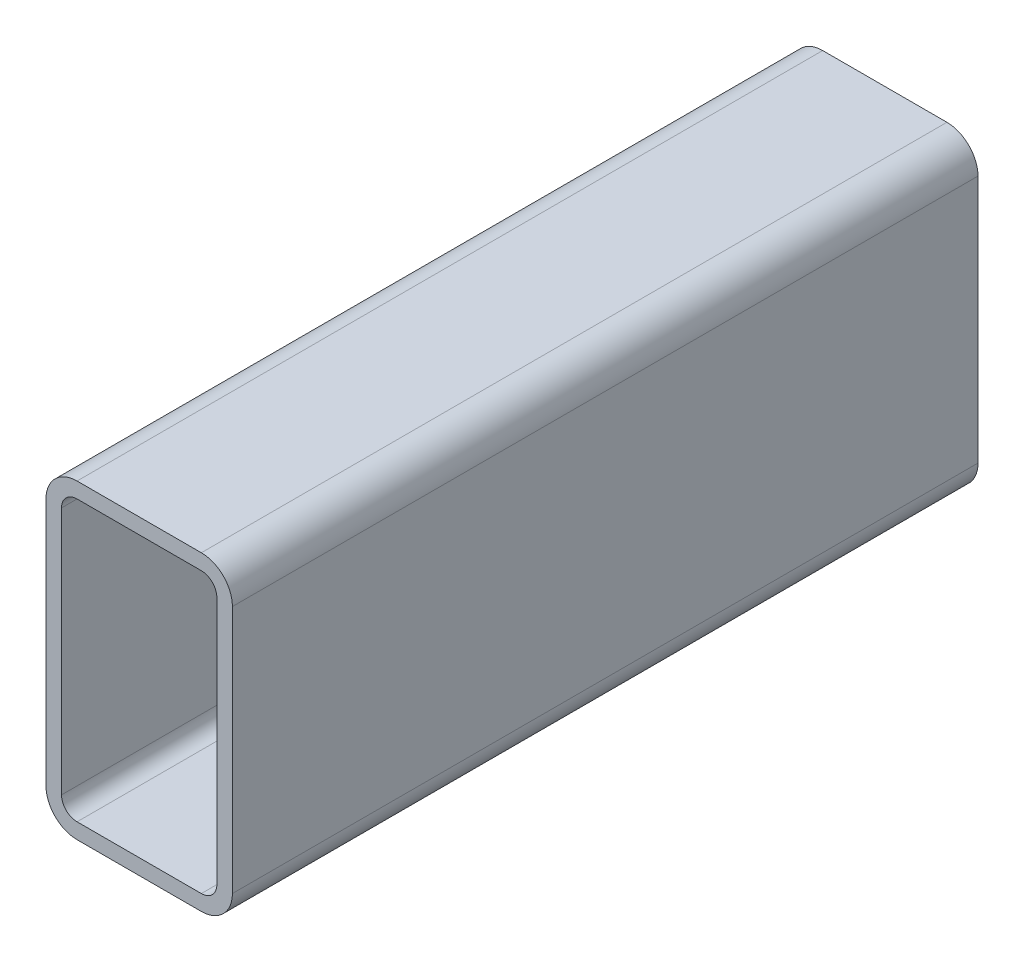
SolidWorks part; units mm, degrees
ref_plane "Front Plane" through (0, 0, 0) normal (0, 0, 1) x (1, 0, 0)
ref_plane "Top Plane" through (0, 0, 0) normal (0, 1, 0) x (1, 0, 0)
ref_plane "Right Plane" through (0, 0, 0) normal (1, 0, 0) x (0, 0, -1)
sketch "Sketch1" plane through (0, 0, 0) normal (0, 0, 1) x (1, 0, 0)
sketch_block_instance "HSS5x3x0.250-1"
sketch_block "HSS5x3x0.250"
extrude "Boss-Extrude1" add sketch "Sketch1" along normal blind 304.8
